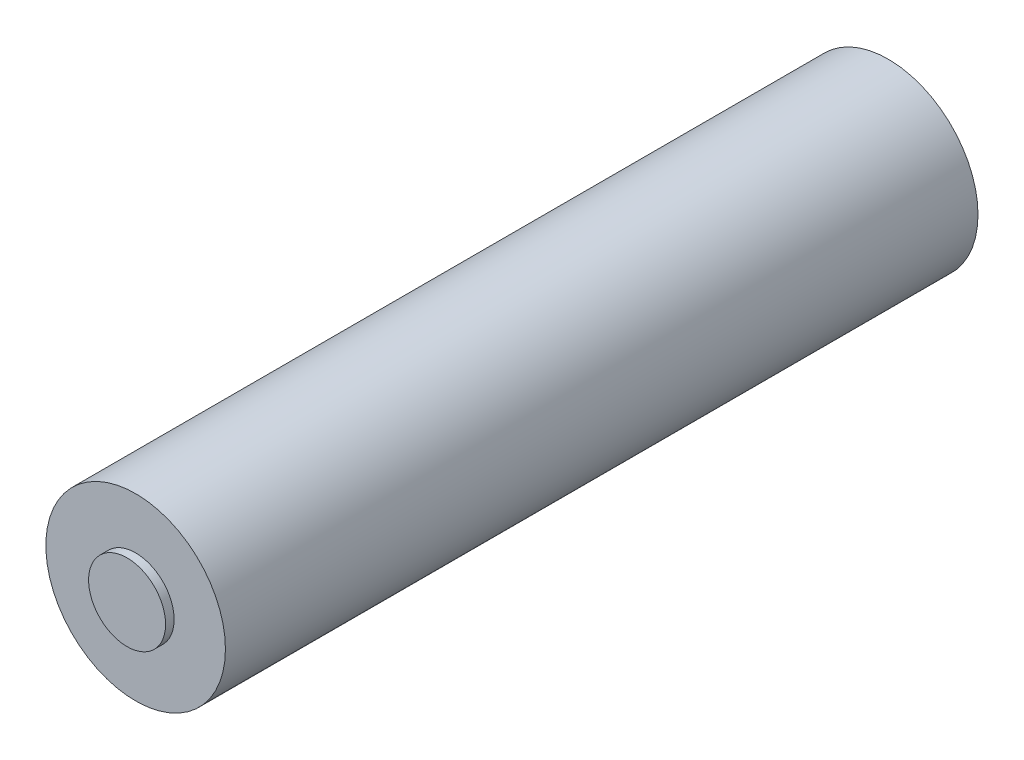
SolidWorks part; units mm, degrees
ref_plane "Plan de face" through (0, 0, 0) normal (0, 0, 1) x (1, 0, 0)
ref_plane "Plan de dessus" through (0, 0, 0) normal (0, 1, 0) x (1, 0, 0)
ref_plane "Plan de droite" through (0, 0, 0) normal (1, 0, 0) x (0, 0, -1)
sketch "Esquisse1" plane through (0, 0, 0) normal (0, 0, 1) x (1, 0, 0)
  circle A0 centre (0, 0) radius 5.25
  dimension "D1" = 10.5
extrude "Extrusion1" add sketch "Esquisse1" along normal blind 44
sketch "Esquisse2" plane through (0, 0, 44) normal (0, 0, 1) x (1, 0, 0)
  circle A0 centre (0, 0) radius 2.25
  dimension "D1" = 4.5
extrude "Extrusion2" add sketch "Esquisse2" along normal blind 0.5
